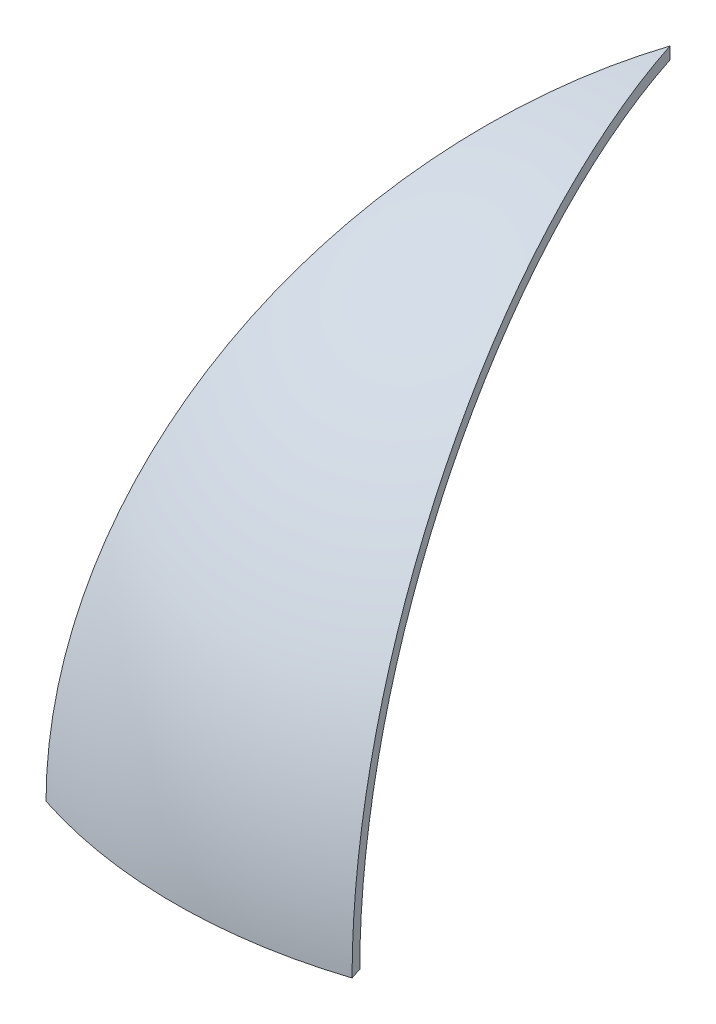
SolidWorks part; units mm, degrees
ref_plane "Vorne" through (0, 0, 0) normal (0, 0, 1) x (1, 0, 0)
ref_plane "Oben" through (0, 0, 0) normal (0, 1, 0) x (1, 0, 0)
ref_plane "Rechts" through (0, 0, 0) normal (1, 0, 0) x (0, 0, -1)
sketch "Skizze1" plane through (0, 0, 0) normal (1, 0, 0) x (0, 0, -1)
  line L0 (0, 0) -> (0, 1000)
  line L1 (0, 0) -> (1000, 0)
  arc A0 (1000, 0) -> (0, 1000) centre (0, 0) ccw
  dimension "D3" = 2000
sketch "Skizze2" plane through (0, 0, 0) normal (1, 0, 0) x (0, 0, -1)
  line L0 (0, 0) -> (0, 1025)
  line L1 (0, 0) -> (1025, 0)
  arc A0 (1025, 0) -> (0, 1025) centre (0, 0) ccw
  dimension "D1" = 2050
revolve "Rotation3" add sketch "Skizze2" angle 360 about L0
revolve "Schnitt-Rotation1" cut sketch "Skizze1" angle 360 about L0
sketch "Skizze4" plane through (0, 0, 0) normal (0, -1, 0) x (1, 0, 0)
  line L0 (0, 0) -> (-324.4678, 998.6093)
  line L1 (0, 0) -> (324.4678, 998.6093)
  line L3 (0, 1225.6242) -> (0, -1279.6025) construction
  arc A0 (-324.4678, 998.6093) -> (324.4678, 998.6093) centre (0, 0) ccw
  dimension "D1" = 18
  dimension "D2" = 18
extrude "Schnitt-Linear austragen1" cut sketch "Skizze4" against normal blind 1500
